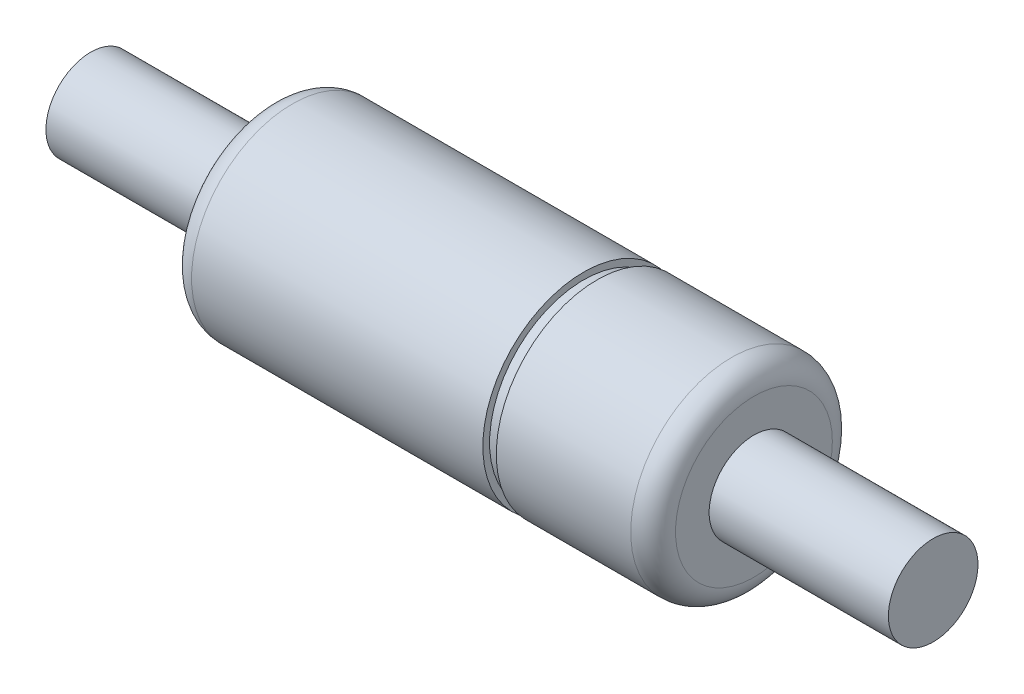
SolidWorks part; units mm, degrees
ref_plane "Vorderseite" through (0, 0, 0) normal (0, 0, 1) x (1, 0, 0)
ref_plane "oben" through (0, 0, 0) normal (0, 1, 0) x (-1, 0, 0)
ref_plane "rechts" through (0, 0, 0) normal (1, 0, 0) x (0, 0, -1)
sketch "Skizze1" plane through (0, 0, 0) normal (0, 0, 1) x (1, 0, 0)
  line L0 (2.9742, 0) -> (-8.1364, 0) construction
  line L1 (-10.8, 1) -> (-10.8, 1.75)
  line L2 (-10.3, 2.25) -> (-3.8, 2.25)
  line L3 (-3.8, 2.25) -> (-3.8, 2.1)
  line L4 (-3.8, 2.1) -> (-3.5, 2.1)
  line L5 (-3.5, 2.1) -> (-3.5, 2.25)
  line L6 (-3.5, 2.25) -> (-0.5, 2.25)
  line L7 (0, 1.75) -> (0, 1)
  line L8 (4, 0) -> (-14.8, 0)
  line L9 (-10.8, 1) -> (-14.8, 1)
  line L10 (0, 1) -> (4, 1)
  line L11 (-14.8, 1) -> (-14.8, 0)
  line L12 (4, 1) -> (4, 0)
  arc A0 (-0.5, 2.25) -> (0, 1.75) centre (-0.5, 1.75) cw
  arc A1 (-10.8, 1.75) -> (-10.3, 2.25) centre (-10.3, 1.75) cw
  point P17 (0, 2.25)
  dimension "D7" = 0.5
  dimension "D1" = 4.2
  dimension "D2" = 0.3
  dimension "D3" = 7
  dimension "D4" = 3.5
  dimension "D5" = 4.5
  dimension "D6" = 2
  dimension "D8" = 4
  dimension "D9" = 4
revolve "Rotation3" add sketch "Skizze1" angle 360 about L0
